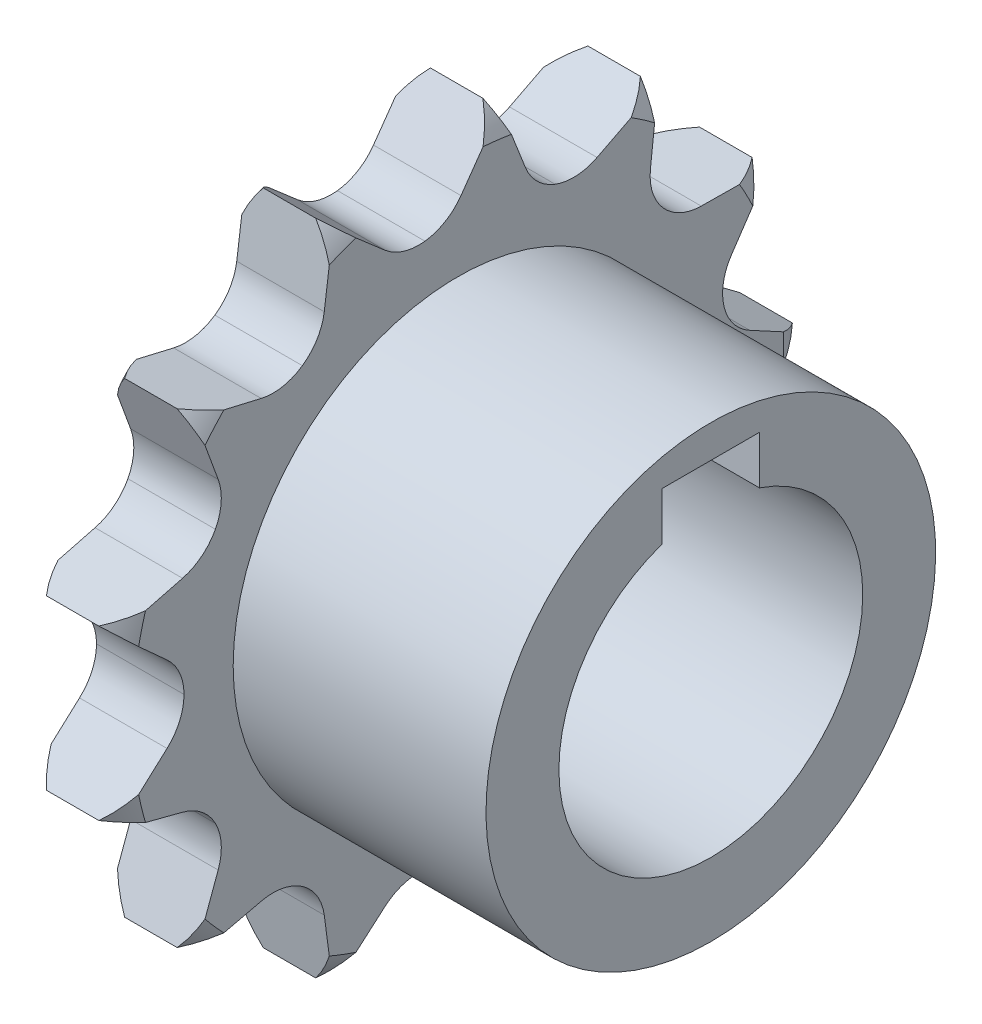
SolidWorks part; units mm, degrees
ref_plane "Plan de face" through (0, 0, 0) normal (0, 0, 1) x (1, 0, 0)
ref_plane "Plan de dessus" through (0, 0, 0) normal (0, 1, 0) x (1, 0, 0)
ref_plane "Plan de droite" through (0, 0, 0) normal (1, 0, 0) x (0, 0, -1)
imported_body "Importée1"
sketch "Esquisse1" plane through (28, 0, 0) normal (1, 0, 0) x (0, 0, -1)
  line L2 (-4, 11.8427) -> (-4, 15.8)
  line L3 (-4, 15.8) -> (4, 15.8)
  line L4 (4, 11.8427) -> (4, 15.8)
  arc A0 (-4, 11.8427) -> (4, 11.8427) centre (0, 0) ccw
  dimension "D3" = 25
  dimension "D4" = 28.3
  dimension "D1" = 4
  dimension "D2" = 8
extrude "Enlèv. mat.-Extru.1" cut sketch "Esquisse1" against normal through all
ref_plane "Plan1" through (3.6, 0, 0) normal (-1, 0, 0) x (0, 0, 1)
sketch "Esquisse2" plane through (3.6, 0, 0) normal (-1, 0, 0) x (0, 0, 1)
  circle A0 centre (0, 0) radius 26.53 construction
  dimension "D1" = 53.06
